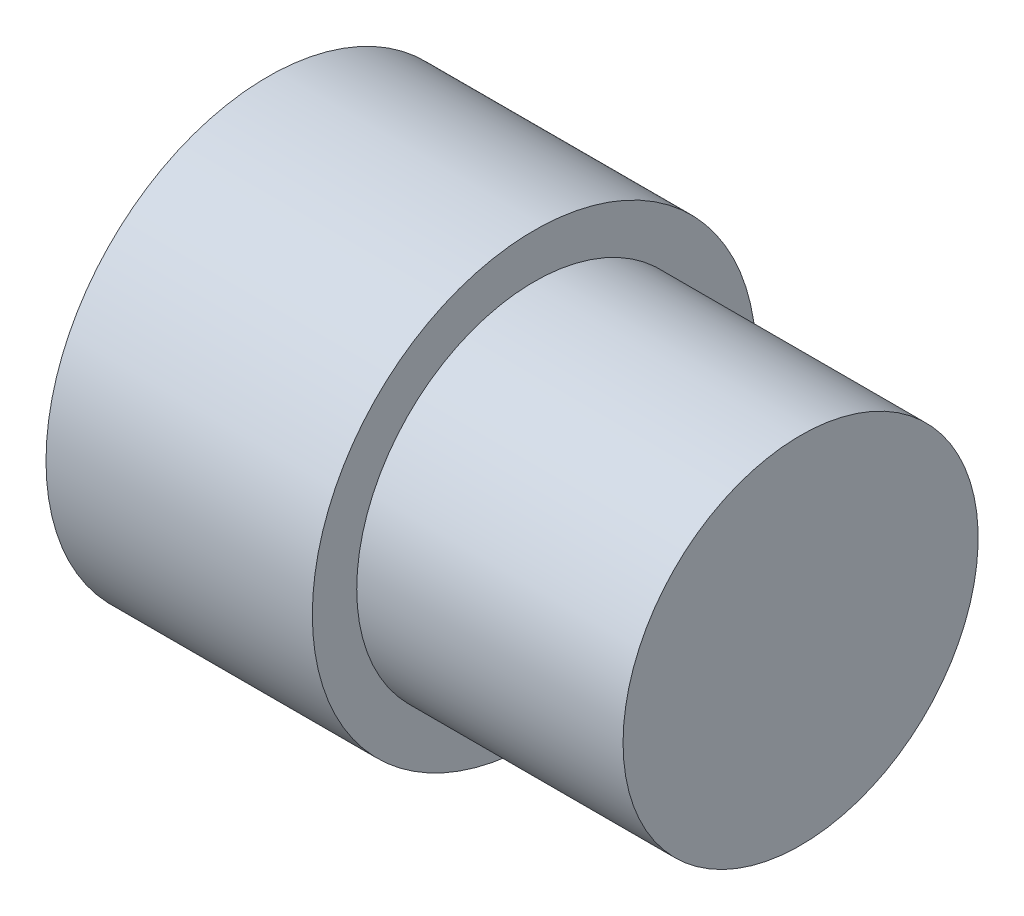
SolidWorks part; units mm, degrees
ref_plane "Front" through (0, 0, 0) normal (0, 0, 1) x (1, 0, 0)
ref_plane "Top" through (0, 0, 0) normal (0, 1, 0) x (1, 0, 0)
ref_plane "Right" through (0, 0, 0) normal (1, 0, 0) x (0, 0, -1)
sketch "Sketch1" plane through (0, 0, 0) normal (0, 1, 0) x (1, 0, 0)
  line L0 (0, 0) -> (6, 0)
  line L1 (6, 0) -> (6, 2)
  line L2 (6, 2) -> (3, 2)
  line L3 (3, 2) -> (3, 2.5)
  line L4 (3, 2.5) -> (0, 2.5)
  line L5 (0, 2.5) -> (0, 0)
revolve "Revolve1" add sketch "Sketch1" angle 360 about L0
